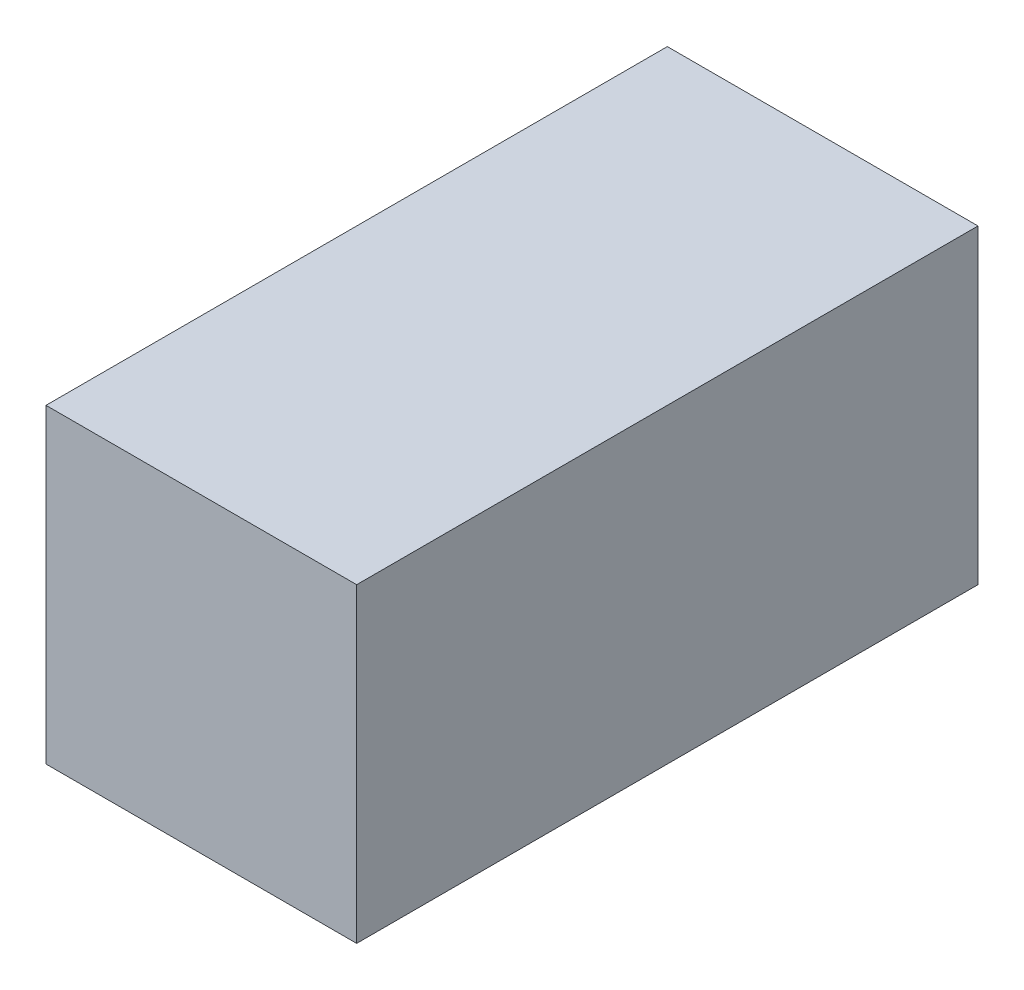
SolidWorks part; units mm, degrees
ref_plane "Face" through (0, 0, 0) normal (0, 0, 1) x (1, 0, 0)
ref_plane "Dessus" through (0, 0, 0) normal (0, 1, 0) x (1, 0, 0)
ref_plane "Droite" through (0, 0, 0) normal (1, 0, 0) x (0, 0, -1)
sketch "Esquisse1" plane through (0, 0, 0) normal (0, 0, 1) x (1, 0, 0)
  line L1 (0, 0) -> (4, 0)
  line L2 (0, 0) -> (0, 4)
  line L3 (0, 4) -> (4, 4)
  line L4 (4, 0) -> (4, 4)
  dimension "D1" = 4
extrude "Base-Extrusion" add sketch "Esquisse1" along normal blind 8
